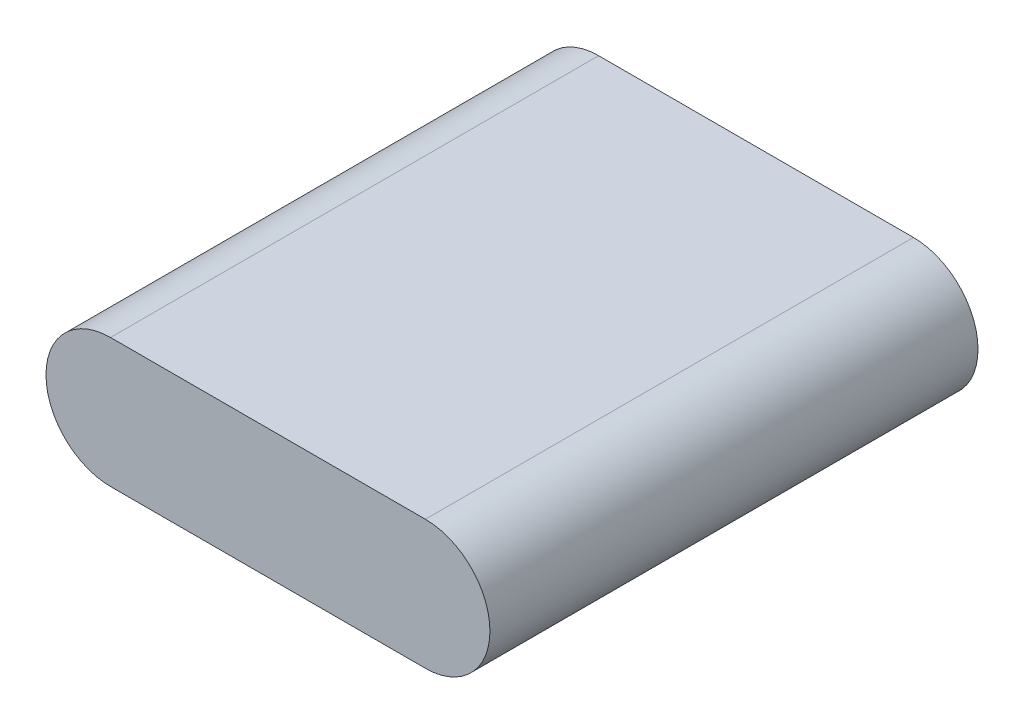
SolidWorks part; units mm, degrees
ref_plane "Front" through (0, 0, 0) normal (0, 0, 1) x (1, 0, 0)
ref_plane "Top" through (0, 0, 0) normal (0, 1, 0) x (1, 0, 0)
ref_plane "Right" through (0, 0, 0) normal (1, 0, 0) x (0, 0, -1)
sketch "Sketch1" plane through (0, 0, 0) normal (0, 0, 1) x (1, 0, 0)
  line L0 (-27.4447, 0) -> (27.4447, 0) construction
  line L1 (-27.4447, 11.2522) -> (27.4447, 11.2522)
  line L2 (-27.4447, -11.2522) -> (27.4447, -11.2522)
  line L3 (-38.6969, 0) -> (38.6969, 0) construction
  arc A0 (-27.4447, 11.2522) -> (-27.4447, -11.2522) centre (-27.4447, 0) ccw
  arc A1 (27.4447, -11.2522) -> (27.4447, 11.2522) centre (27.4447, 0) ccw
  point P2 (0, 0)
  dimension "D2" = 54.8894
  dimension "D1" = 22.5044
  dimension "D3" = 77.3938
extrude "Boss-Extrude1" add sketch "Sketch1" along normal mid plane 85.09
